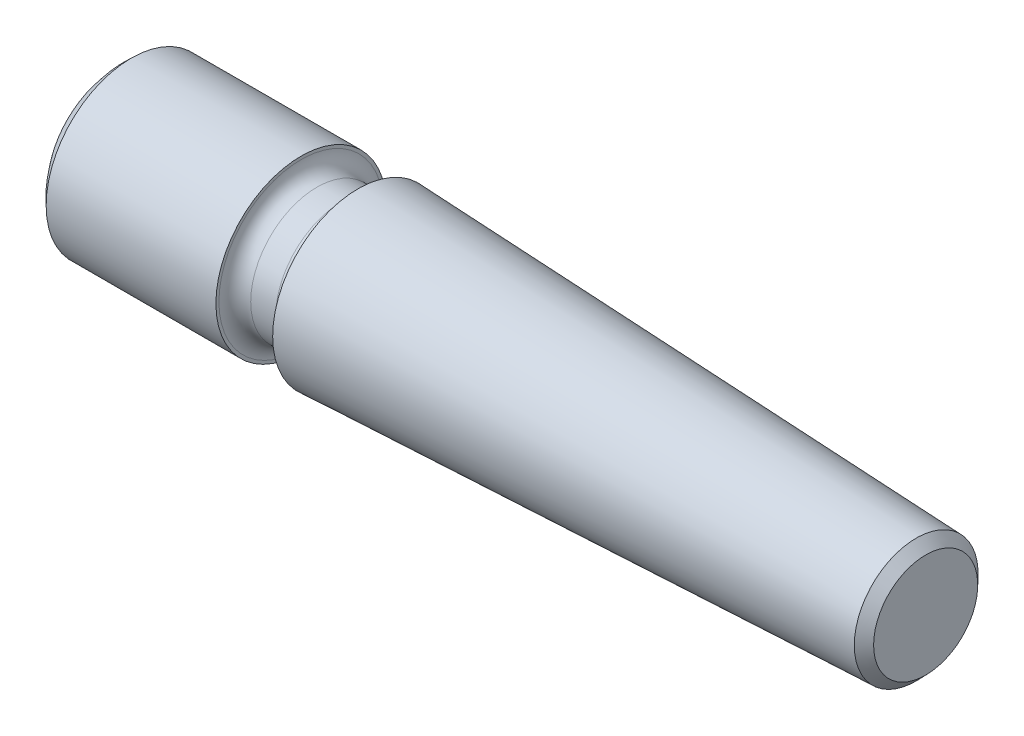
SolidWorks part; units mm, degrees
ref_plane "Front Plane" through (0, 0, 0) normal (0, 0, 1) x (1, 0, 0)
ref_plane "Top Plane" through (0, 0, 0) normal (0, 1, 0) x (1, 0, 0)
ref_plane "Right Plane" through (0, 0, 0) normal (1, 0, 0) x (0, 0, -1)
sketch "Sketch1" plane through (0, 0, 0) normal (0, 0, 1) x (1, 0, 0)
  line L0 (-44, 0) -> (0, 0) construction
  line L1 (0, 0) -> (0, 2.75)
  line L2 (-0.4996, 3.2708) -> (-30, 4.5)
  line L3 (-33, 4.5) -> (-33, 4.34)
  line L4 (-32.16, 3.5) -> (-30.84, 3.5)
  line L5 (-30, 4.34) -> (-30, 4.5)
  line L6 (-33, 4.5) -> (-41.9686, 4.5)
  line L7 (-44, 0) -> (0, 0)
  line L8 (0, 2.75) -> (-0.4996, 3.2708)
  line L9 (-44, 0) -> (-44, 4) construction
  arc A0 (-30.84, 3.5) -> (-30, 4.34) centre (-30.84, 4.34) ccw
  arc A1 (-33, 4.34) -> (-32.16, 3.5) centre (-32.16, 4.34) ccw
  arc A2 (-41.9686, 4.5) -> (-44, 0) centre (-38, 0) ccw
  point P4 (0, 3.25)
  point P12 (-30, 3.5)
  point P13 (-30, 3.5)
  point P15 (-33, 3.5)
  point P17 (-33, 3.5)
  dimension "D4" = 0.84
  dimension "D7" = 6
  dimension "D1" = 4.5
  dimension "D2" = 1
  dimension "D3" = 3
  dimension "D5" = 3.25
  dimension "D6" = 44
  dimension "D9" = 30
  dimension "D10" = 0.5
  dimension "D11" = 0.5
revolve "Revolve1" add sketch "Sketch1" angle 360 about L0
